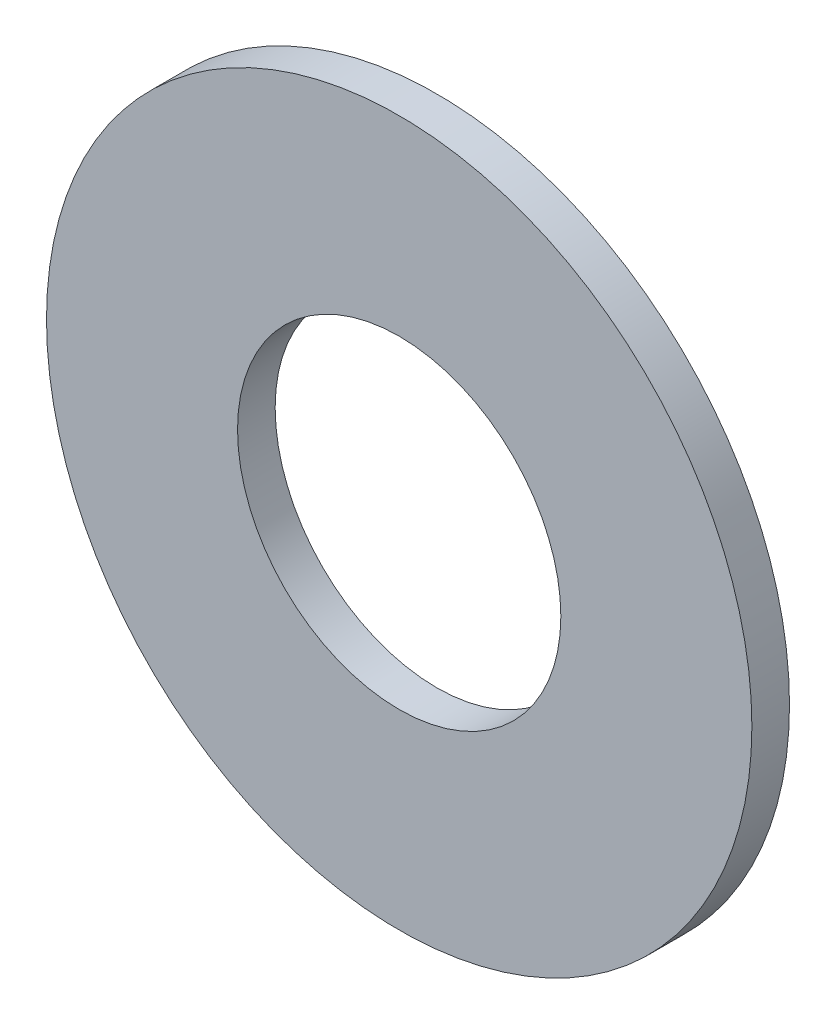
SolidWorks part; units mm, degrees
ref_plane "Front Plane" through (0, 0, 0) normal (0, 0, 1) x (1, 0, 0)
ref_plane "Top Plane" through (0, 0, 0) normal (0, 1, 0) x (1, 0, 0)
ref_plane "Right Plane" through (0, 0, 0) normal (1, 0, 0) x (0, 0, -1)
sketch "Sketch1" plane through (0, 0, 0) normal (0, 0, 1) x (1, 0, 0)
  circle A0 centre (0, 0) radius 2.1828
  circle A1 centre (0, 0) radius 4.7625
  dimension "ID" = 4.3656
  dimension "OD" = 9.525
extrude "Extrude1" add sketch "Sketch1" against normal blind 0.508
